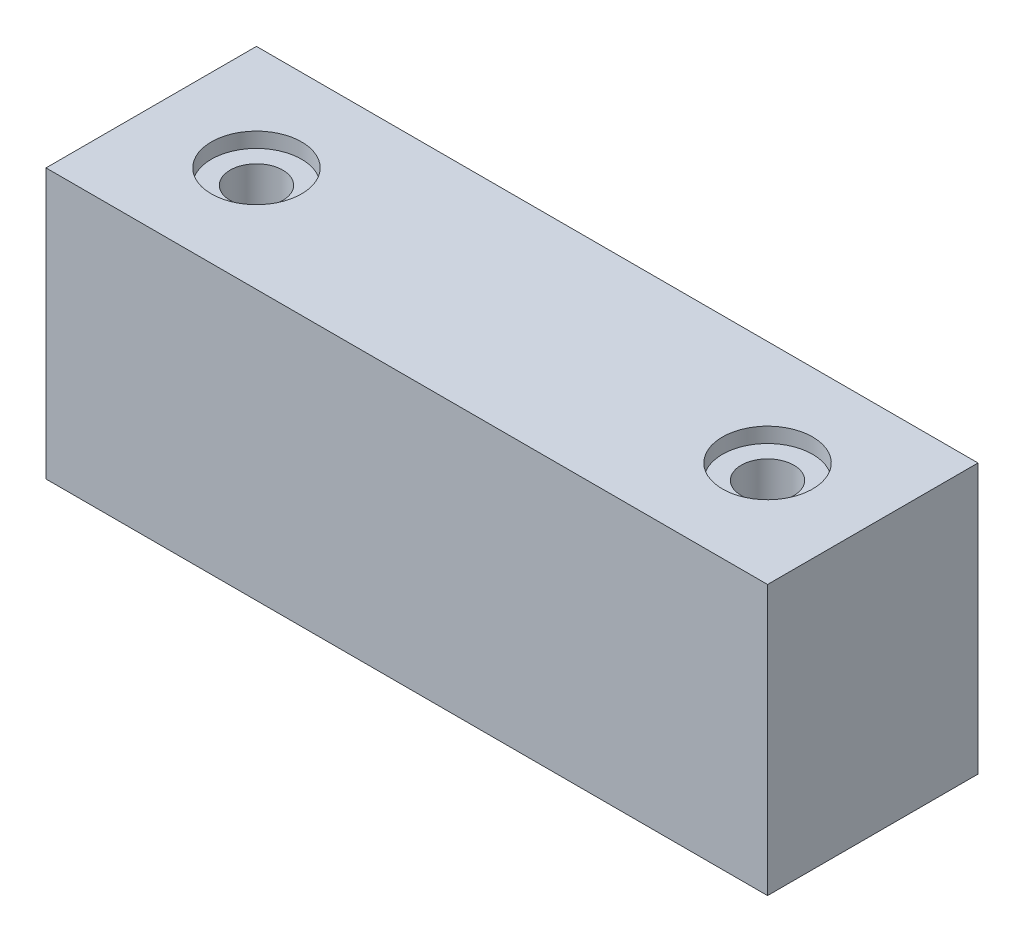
SolidWorks part; units mm, degrees
ref_plane "Front Plane" through (0, 0, 0) normal (0, 0, 1) x (1, 0, 0)
ref_plane "Top Plane" through (0, 0, 0) normal (0, 1, 0) x (1, 0, 0)
ref_plane "Right Plane" through (0, 0, 0) normal (1, 0, 0) x (0, 0, -1)
sketch "Sketch1" plane through (0, 0, 0) normal (0, 0, 1) x (1, 0, 0)
  line L1 (-128.2262, -19.6505) -> (176.5738, -19.6505)
  line L2 (-128.2262, -19.6505) -> (-128.2262, -133.4814)
  line L3 (-128.2262, -133.4814) -> (176.5738, -133.4814)
  line L4 (176.5738, -19.6505) -> (176.5738, -133.4814)
extrude "Boss-Extrude1" add sketch "Sketch1" along normal blind 88.9 contours L2 L1 L4 L3
sketch "Sketch2" plane through (0, -19.6505, 0) normal (0, 1, 0) x (1, 0, 0)
  line L0 (-128.2262, -88.9) -> (-128.2262, 0) construction
  line L1 (-128.2262, -88.9) -> (176.5738, -88.9) construction
  line L2 (24.1738, 0) -> (24.1738, -150.1325) construction
  line L4 (-128.2262, 0) -> (176.5738, 0) construction
  circle A0 centre (-83.7762, -44.45) radius 19.05
  circle A1 centre (132.1238, -44.45) radius 19.05
  dimension "D1" = 38.1
  dimension "D2" = 44.45
  dimension "D3" = 44.45
extrude "Cut-Extrude1" cut sketch "Sketch2" against normal blind 6.35
sketch "Sketch3" plane through (0, -26.0005, 0) normal (0, 1, 0) x (1, 0, 0)
  line L0 (24.1738, 0) -> (24.1738, -130.286) construction
  line L1 (-128.2262, 0) -> (176.5738, 0) construction
  circle A0 centre (-83.7762, -44.45) radius 11.1125
  circle A1 centre (132.1238, -44.45) radius 11.1125
  dimension "D1" = 22.225
extrude "Cut-Extrude2" cut sketch "Sketch3" against normal through all
equation "\"H\"= ( ( 3 * \"Load\" * ( 1 / 4.45 ) * \"span\" ) / ( \"Cw\" * \"stress\" ) ) ^ ( 1 / 3 )"
equation "\"Load\"= 2000'Load in Newtons"
equation "\"SF\"= 4"
equation "\"Cw\"= 3.5'inches"
equation "\"stress\"= 42.8'psi"
equation "\"span\"= 10'in"
equation "\"D2@Sketch1\"=\"H\""
equation "\"D1@Boss-Extrude1\"=\"Cw\""
